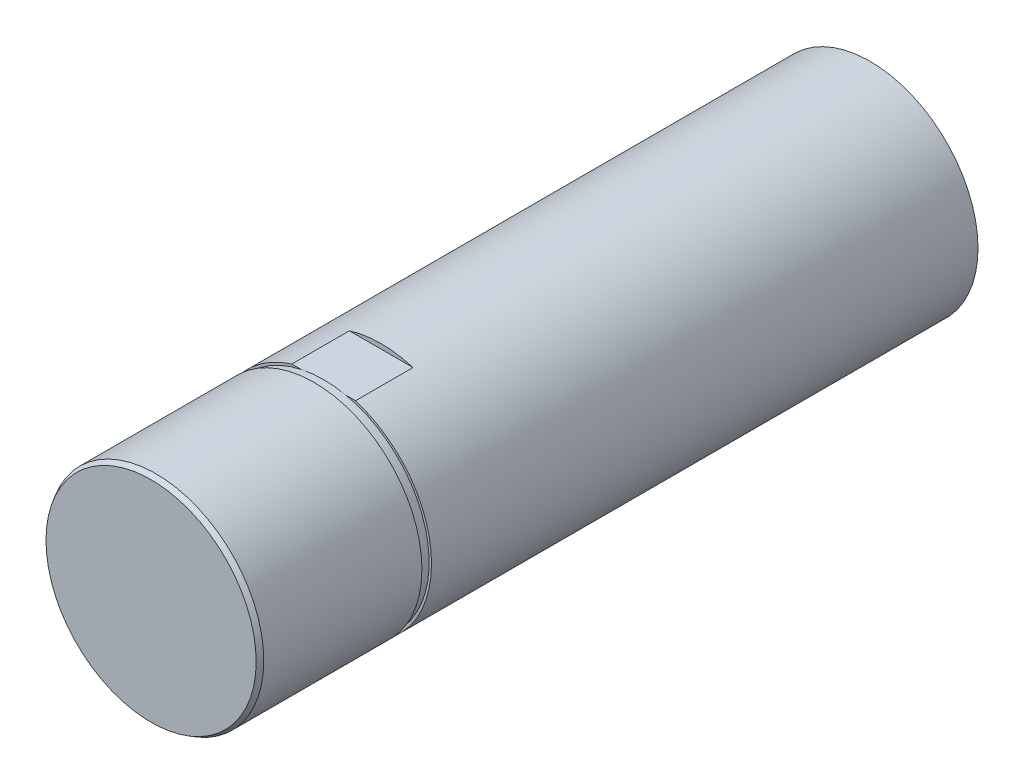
SolidWorks part; units mm, degrees
ref_plane "Front Plane" through (0, 0, 0) normal (0, 0, 1) x (1, 0, 0)
ref_plane "Top Plane" through (0, 0, 0) normal (0, 1, 0) x (1, 0, 0)
ref_plane "Right Plane" through (0, 0, 0) normal (1, 0, 0) x (0, 0, -1)
sketch "Sketch1" plane through (0, 0, 0) normal (0, 0, 1) x (1, 0, 0)
  circle A0 centre (0, 0) radius 22.5
  dimension "D1" = 45
extrude "STROKE" add sketch "Sketch1" against normal blind 100
sketch "Sketch2" plane through (0, 0, 0) normal (0, 0, 1) x (1, 0, 0)
  circle A0 centre (0, 0) radius 22.5
  dimension "D1" = 45
extrude "L2" add sketch "Sketch2" along normal blind 14
ref_plane "Plane1" through (0, 0, 14) normal (0, 0, 1) x (1, 0, 0)
sketch "Sketch3" plane through (0, 0, 14) normal (0, 0, 1) x (1, 0, 0)
  circle A0 centre (0, 0) radius 22.5
  dimension "D1" = 45
extrude "L3" add sketch "Sketch3" along normal blind 36
chamfer "Chamfer2" distance 1 angle 30 1 edges at (22.5, 0, 50)
sketch "Sketch5" plane through (0, 0, 14) normal (0, 0, 1) x (1, 0, 0)
  circle A0 centre (0, 0) radius 22.5
  circle A1 centre (0, 0) radius 22
  circle A4 centre (0, 0) radius 22.5 construction
  dimension "D1" = 45
  dimension "D2" = 44
extrude "U/C" cut sketch "Sketch5" along normal blind 2
sketch "Sketch6" plane through (0, 0, 0) normal (1, 0, 0) x (0, 0, -1)
  line L0 (-50, 21.9226) -> (-50, -21.9226) construction
  line L1 (-14, 23) -> (-2, 23)
  line L2 (-14, -21.5) -> (-14, -23)
  line L3 (-14, 21.5) -> (-2, 21.5)
  line L4 (-2, 23) -> (-2, 21.5)
  line L5 (-14, -21.5) -> (-2, -21.5)
  line L6 (-14, 23) -> (-14, 21.5)
  line L7 (-14, -23) -> (-2, -23)
  line L8 (-2, -21.5) -> (-2, -23)
  line L9 (100, -22.5) -> (100, 22.5) construction
  line L10 (100, 0) -> (-14, 0) construction
  line L12 (100, 0) -> (-14, 0) construction
  dimension "D1" = 12
  dimension "D2" = 43
  dimension "D3" = 21.5
  dimension "D4" = 36
  dimension "D5" = 46
  dimension "D6" = 45
  dimension "D7" = 23
extrude "A/F" cut sketch "Sketch6" against normal mid plane 21
equation "\"D2@Sketch5\" = \"D1@Sketch5\" - 1"
equation "\"D5@Sketch6\" = \"D2@Sketch6\"+3"
equation "\"D3@Sketch6\" = \"D2@Sketch6\" / 2"
equation "\"D2@Sketch6\" = \"D6@Sketch6\"-2"
equation "\"D7@Sketch6\" = \"D5@Sketch6\"/2"
